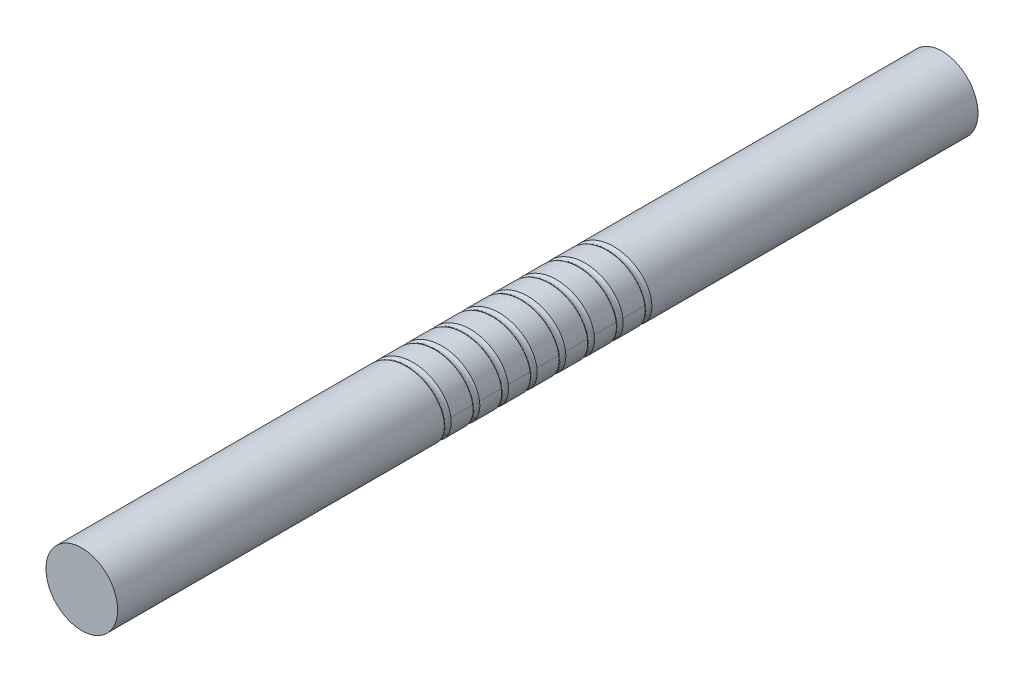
SolidWorks part; units mm, degrees
ref_plane "Front Plane" through (0, 0, 0) normal (0, 0, 1) x (1, 0, 0)
ref_plane "Top Plane" through (0, 0, 0) normal (0, 1, 0) x (1, 0, 0)
ref_plane "Right Plane" through (0, 0, 0) normal (1, 0, 0) x (0, 0, -1)
sketch "Sketch1" plane through (0, 0, 0) normal (0, 0, 1) x (1, 0, 0)
  circle A0 centre (0, 0) radius 25
  dimension "D1" = 50
extrude "Boss-Extrude1" add sketch "Sketch1" along normal blind 600
ref_plane "Plane1" through (0, 0, 220) normal (0, 0, 1) x (1, 0, 0)
sketch "Sketch2" plane through (0, 0, 220) normal (0, 0, 1) x (1, 0, 0)
  circle A0 centre (0, 0) radius 27.1167
  dimension "D1" = 54.2333
curve "Helix/Spiral1"
sketch "Sketch3" plane through (0, 0, 0) normal (0, 1, 0) x (1, 0, 0)
  circle A0 centre (-27.1167, -220) radius 3.175
  spline S0 degree 3 number of poles 188 (-27.1167, -220) -> (-27.1167, -380) construction
  dimension "D1" = 6.35
sweep "Cut-Sweep1" cut profiles "Sketch3" path "Helix/Spiral1"
pattern_linear "LPattern1" [suppressed] count 2 spacing 500
